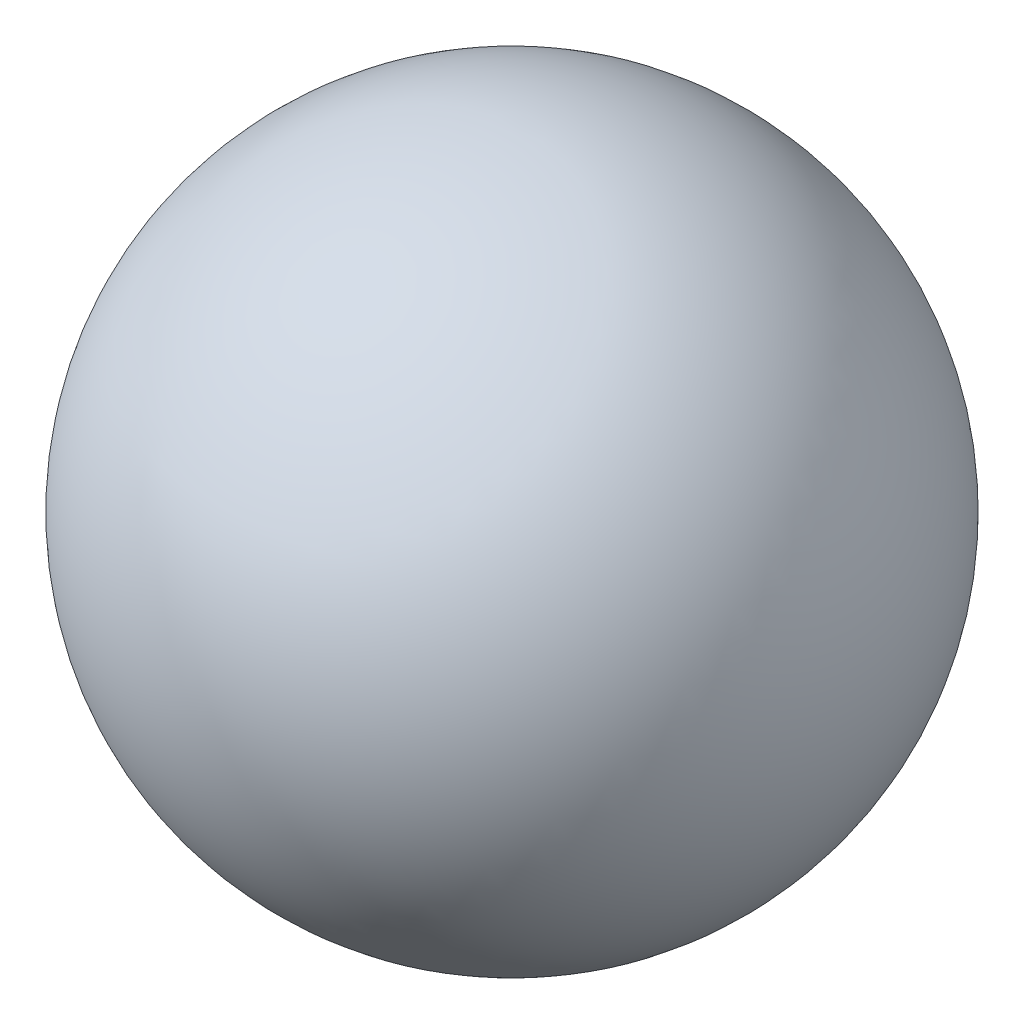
SolidWorks part; units mm, degrees
ref_plane "正面" through (0, 0, 0) normal (0, 0, 1) x (1, 0, 0)
ref_plane "平面" through (0, 0, 0) normal (0, 1, 0) x (1, 0, 0)
ref_plane "右側面" through (0, 0, 0) normal (1, 0, 0) x (0, 0, -1)
sketch "ｽｹｯﾁ1" plane through (0, 0, 0) normal (0, 0, 1) x (1, 0, 0)
  line L0 (0, 0) -> (0, 100)
  line L1 (0, 0) -> (0, 128.5303) construction
  arc A0 (0, 0) -> (0, 100) centre (0, 50) ccw
  dimension "D1" = 50
revolve "回転1" add sketch "ｽｹｯﾁ1" angle 360 about L1
